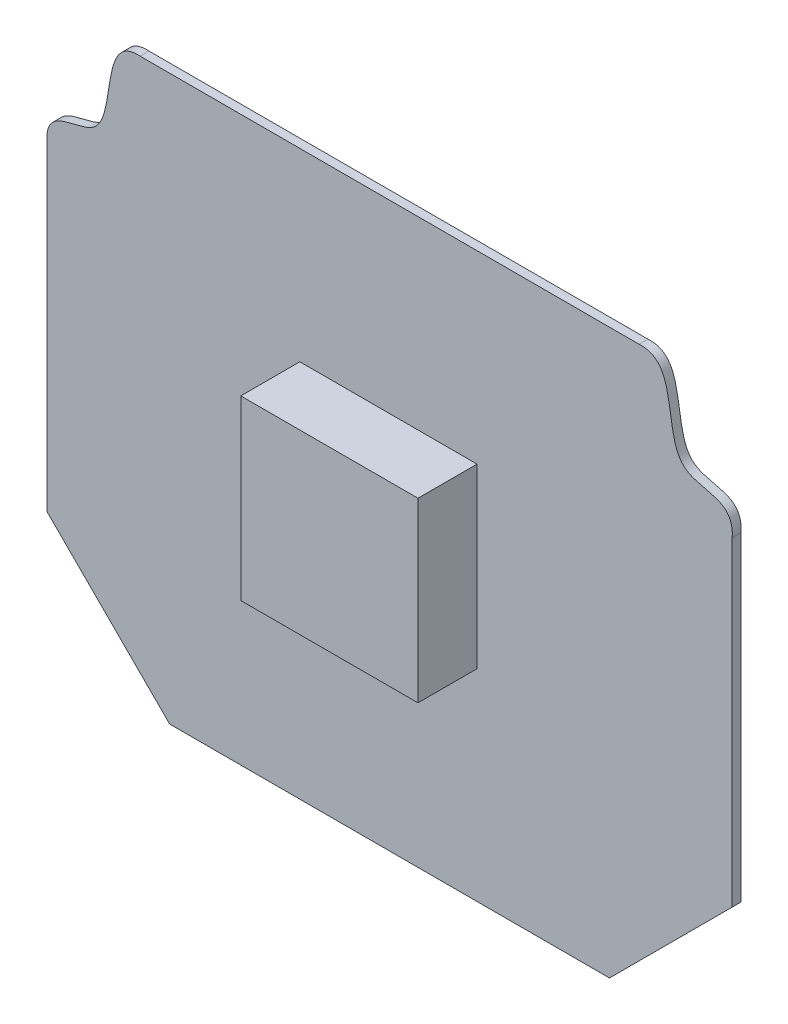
SolidWorks part; units mm, degrees
ref_plane "Płaszczyzna przednia" through (0, 0, 0) normal (0, 0, 1) x (1, 0, 0)
ref_plane "Płaszczyzna górna" through (0, 0, 0) normal (0, 1, 0) x (1, 0, 0)
ref_plane "Płaszczyzna prawa" through (0, 0, 0) normal (1, 0, 0) x (0, 0, -1)
sketch "Szkic1" plane through (0, 0, 0) normal (0, 0, 1) x (1, 0, 0)
  line L2 (-102.2398, 144.542) -> (-17.7602, 144.542)
  line L3 (-118, 124.0441) -> (-118, 69.8953)
  line L4 (-97.2292, 49.1244) -> (-22.7708, 49.1244)
  line L5 (-2, 124.0441) -> (-2, 69.8953)
  line L6 (-107.7048, 136.0736) -> (-13.3965, 58.4988) construction
  line L7 (-106.6035, 58.4988) -> (-2, 144.542) construction
  line L10 (-114.6409, 128.6719) -> (-0.1522, 66.8963) construction
  line L11 (-54.3018, 101.5204) -> (-60, 114.9706) construction
  line L13 (-118, 69.8953) -> (-97.2292, 49.1244)
  line L14 (-60, 96.8332) -> (-60, 130.2929) construction
  line L15 (-2, 69.8953) -> (-22.7708, 49.1244)
  spline S0 degree 3 poles (-118, 124.0441) (-118.407, 129.7724) (-103.9768, 125.766) (-109.2302, 144.9827) (-102.2398, 144.542) knots 0 0 0 0 0.400933 1 1 1 1
  spline S1 degree 3 poles (-2, 124.0441) (-1.593, 129.7724) (-16.0232, 125.766) (-10.7698, 144.9827) (-17.7602, 144.542) knots 0 0 0 0 0.400933 1 1 1 1
  point P8 (-60, 96.8332)
extrude "Dodanie-wyciągnięcie1" add sketch "Szkic1" along normal blind 1.5 contours L2 S1 L5 L15 L4 L13 L3 S0
sketch "Szkic2" plane through (0, 0, 1.5) normal (0, 0, 1) x (1, 0, 0)
  line L0 (-118, 69.8953) -> (-2.3851, 126.6127) construction
  line L2 (-75.1925, 113.254) -> (-45.1925, 113.254)
  line L3 (-75.1925, 113.254) -> (-75.1925, 83.254)
  line L4 (-75.1925, 83.254) -> (-45.1925, 83.254)
  line L5 (-45.1925, 113.254) -> (-45.1925, 83.254)
  line L6 (-75.1925, 113.254) -> (-45.1925, 83.254) construction
  line L7 (-75.1925, 83.254) -> (-45.1925, 113.254) construction
  spline S0 degree 3 poles (-2, 124.0441) (-1.593, 129.7724) (-16.0232, 125.766) (-10.7698, 144.9827) (-17.7602, 144.542) knots 0 0 0 0 0.400933 1 1 1 1 construction
  point P5 (-60.1925, 98.254)
  dimension "D1" = 30
  dimension "D2" = 30
extrude "Dodanie-wyciągnięcie2" add sketch "Szkic2" along normal blind 10 and the other way blind 11.5
